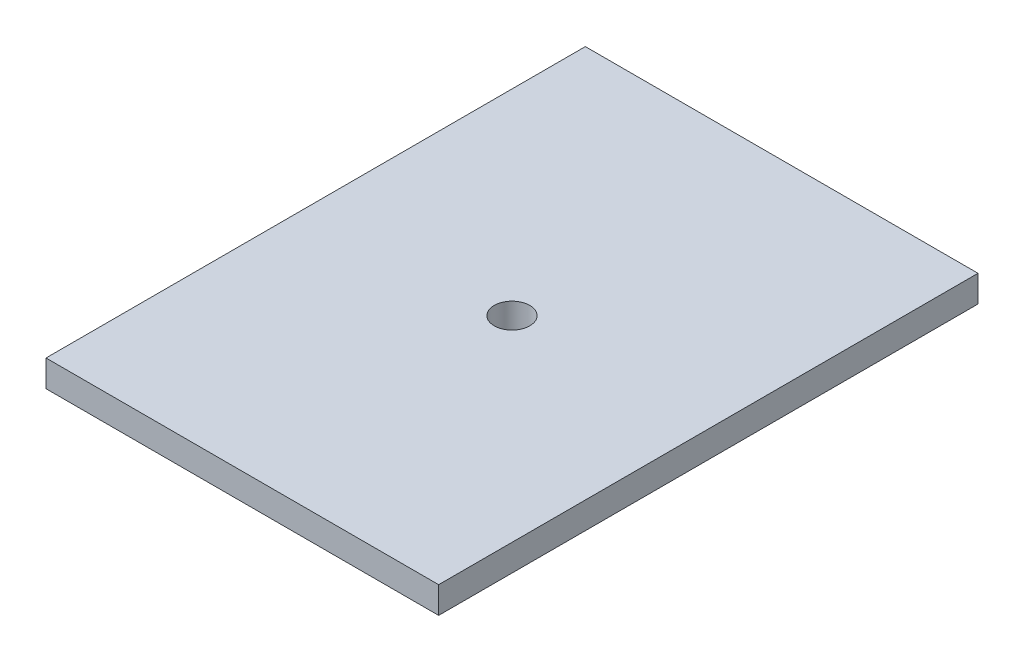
SolidWorks part; units mm, degrees
ref_plane "Vorderansicht" through (0, 0, 0) normal (0, 0, 1) x (1, 0, 0)
ref_plane "Draufsicht" through (0, 0, 0) normal (0, 1, 0) x (1, 0, 0)
ref_plane "Seitenansicht" through (0, 0, 0) normal (1, 0, 0) x (0, 0, -1)
sketch "Skizze1" plane through (0, 0, 0) normal (0, 1, 0) x (1, 0, 0)
  line L0 (0, 0) -> (0, -115.2877) construction
  line L1 (-22.1191, 30.3827) -> (22.1191, 30.3827)
  line L3 (-22.1191, -30.3827) -> (22.1191, -30.3827)
  line L4 (22.1191, 30.3827) -> (22.1191, -30.3827)
  line L5 (0, -47.1625) -> (0, 47.1625) construction
  line L6 (0, 0) -> (-120.1575, 0) construction
  line L10 (-22.1191, -30.3827) -> (-22.1191, 30.3827)
extrude "Linear austragen1" add sketch "Skizze1" along normal blind 3
sketch "Skizze2" plane through (0, 0, 0) normal (0, -1, 0) x (1, 0, 0)
  circle A0 centre (0, 0) radius 2
extrude "Schnitt-Linear austragen1" cut sketch "Skizze2" against normal blind 20
